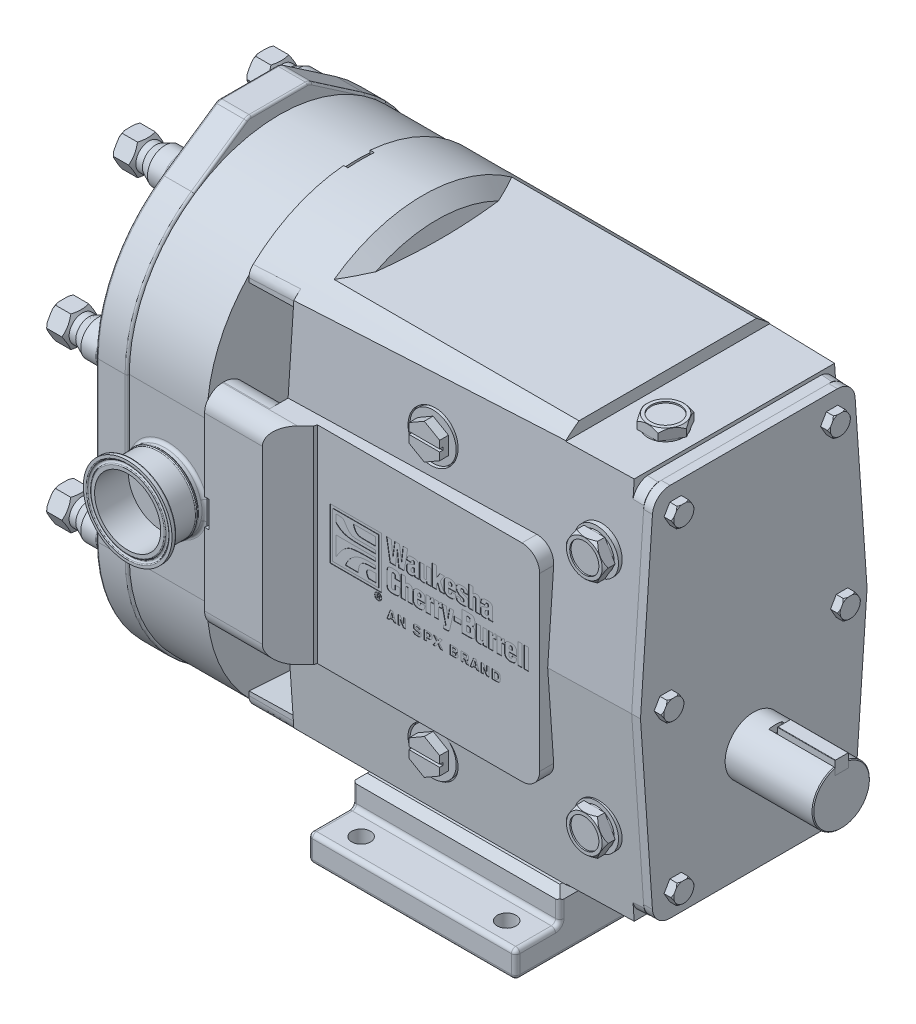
SolidWorks part; units mm, degrees
ref_plane "Front Plane" through (0, 0, 0) normal (0, 0, 1) x (1, 0, 0)
ref_plane "Top Plane" through (0, 0, 0) normal (0, 1, 0) x (1, 0, 0)
ref_plane "Right Plane" through (0, 0, 0) normal (1, 0, 0) x (0, 0, -1)
other "Join1"
other "oil plug<2>@045_U2_Lower Shaft"
other "108371<8>@045_U2_Lower Shaft"
other "108371<7>@045_U2_Lower Shaft"
other "108371<6>@045_U2_Lower Shaft"
other "108371<4>@045_U2_Lower Shaft"
other "108371<3>@045_U2_Lower Shaft"
other "108371<2>@045_U2_Lower Shaft"
other "Key_060<1>@045_U2_Lower Shaft"
other "grease fitting<3>@045_U2_Lower Shaft"
other "grease fitting<1>@045_U2_Lower Shaft"
other "oil plug<6>@045_U2_Lower Shaft"
other "oil plug<5>@045_U2_Lower Shaft"
other "cleanout plug<1>@045_U2_Lower Shaft"
other "oil plug<3>@045_U2_Lower Shaft"
other "oil plug<1>@045_U2_Lower Shaft"
other "Shaft_060<1>@045_U2_Lower Shaft"
other "plate_060<1>@045_U2_Lower Shaft"
other "108371<5>@045_U2_Lower Shaft"
other "108371<1>@045_U2_Lower Shaft"
other "101848<1>@045_U2_Lower Shaft"
other "107233<1>@045_U2_Lower Shaft"
other "070110000<1>@045_U2_Lower Shaft"
other "070005000<1>@045_U2_Lower Shaft"
other "grease fitting<4>@045_U2_Lower Shaft"
other "grease fitting<2>@045_U2_Lower Shaft"
other "cleanout plug<2>@045_U2_Lower Shaft"
other "oil plug<4>@045_U2_Lower Shaft"
other "CD0360006<2>@045_U2_Lower Shaft"
other "CD0360006<1>@045_U2_Lower Shaft"
